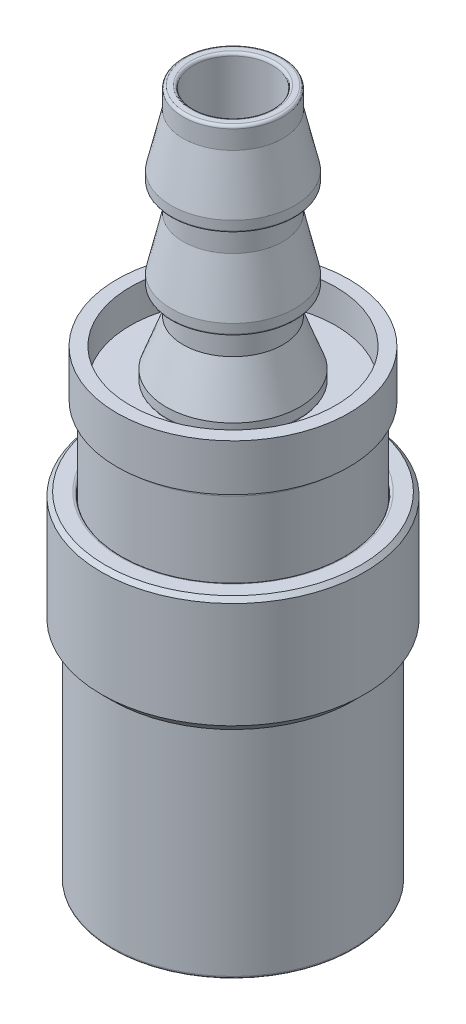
SolidWorks part; units mm, degrees
other "BODY"
ref_plane "Front Plane" through (0, 0, 0) normal (0, 0, 1) x (1, 0, 0)
ref_plane "Top Plane" through (0, 0, 0) normal (0, 1, 0) x (1, 0, 0)
ref_plane "Right Plane" through (0, 0, 0) normal (1, 0, 0) x (0, 0, -1)
imported_body "SC200S"
imported_body "BARB"
imported_body "SLEEVE"
imported_body "PL-BARB"
sketch "Sketch1" plane through (0, 0, 0) normal (0, 0, 1) x (1, 0, 0)
  line L0 (-6.7437, 1.016) -> (-4.7625, 2.9972)
  line L1 (-4.7625, 2.9972) -> (-4.7625, 11.1863)
  line L2 (-4.7625, 11.1863) -> (-6.7437, 13.0794)
  line L3 (-6.7437, 13.0794) -> (-6.7437, 1.016)
  line L4 (0, 8.7926) -> (0, -2.6506) construction
  dimension "D1" = 9.525
revolve "Revolve1" add sketch "Sketch1" angle 360 about L4
sketch "Sketch2" plane through (0, 0, 0) normal (0, -1, 0) x (1, 0, 0)
  line L1 (6.477, -3.7395) -> (6.477, 3.7395)
  line L2 (6.477, 3.7395) -> (0, 7.479)
  line L3 (0, 7.479) -> (-6.477, 3.7395)
  line L4 (-6.477, 3.7395) -> (-6.477, -3.7395)
  line L5 (-6.477, -3.7395) -> (0, -7.479)
  line L6 (0, -7.479) -> (6.477, -3.7395)
  circle A0 centre (0, 0) radius 6.477 construction
  dimension "D1" = 12.954
extrude "Cut-Extrude1" cut sketch "Sketch2" against normal up to surface (15.5119 mm away)
